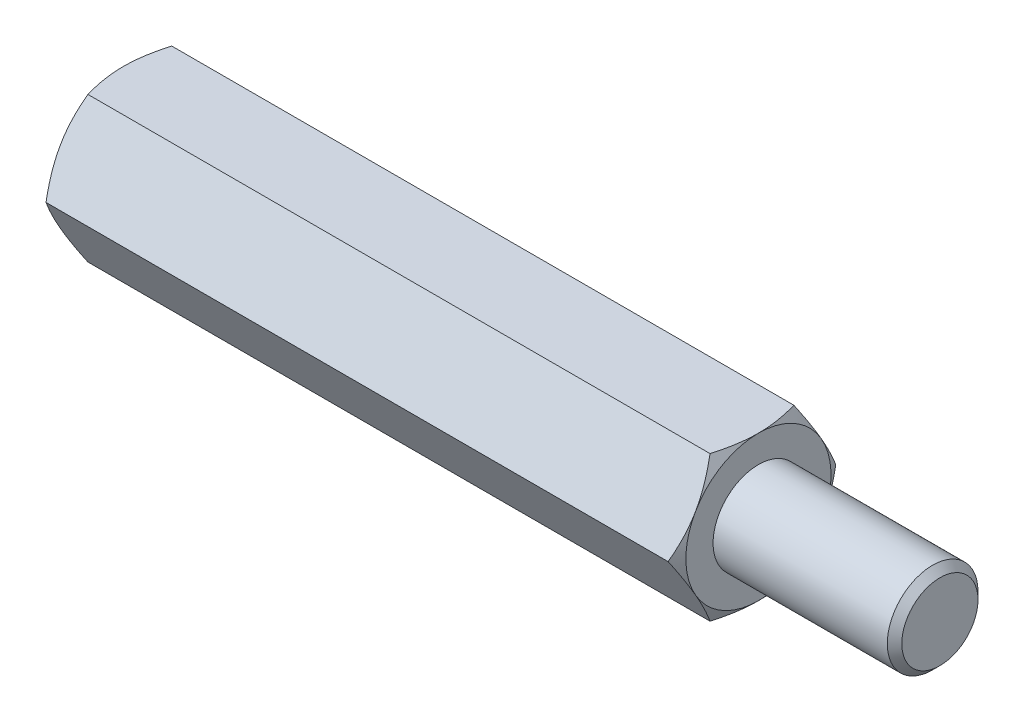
SolidWorks part; units mm, degrees
ref_plane "Front Plane" through (0, 0, 0) normal (0, 0, 1) x (1, 0, 0)
ref_plane "Top Plane" through (0, 0, 0) normal (0, 1, 0) x (1, 0, 0)
ref_plane "Right Plane" through (0, 0, 0) normal (1, 0, 0) x (0, 0, -1)
sketch "Sketch1" plane through (0, 0, 0) normal (1, 0, 0) x (0, 0, -1)
  line L1 (2.3094, 4) -> (-2.3094, 4)
  line L2 (-2.3094, 4) -> (-4.6188, 0)
  line L3 (-4.6188, 0) -> (-2.3094, -4)
  line L4 (-2.3094, -4) -> (2.3094, -4)
  line L5 (2.3094, -4) -> (4.6188, 0)
  line L6 (4.6188, 0) -> (2.3094, 4)
  circle A0 centre (0, 0) radius 4 construction
  dimension "D1" = 8
extrude "Extrude2" add sketch "Sketch1" along normal mid plane 35
sketch "Sketch2" plane through (0, 0, 0) normal (0, 0, 1) x (1, 0, 0)
  line L0 (-17.5, 4) -> (-16, 6.5981)
  line L1 (-17.5, 7) -> (-17.5, 4)
  line L3 (0, 0) -> (50000, 0) construction
  arc A0 (-16, 6.5981) -> (-17.5, 7) centre (-16.6962, 7) ccw
  dimension "D1" = 30
  dimension "D2" = 3
revolve "Cut-Revolve1" cut sketch "Sketch2" angle 360 about L3
mirror "Mirror1" about plane through (0, 0, 0) normal (1, 0, 0) of "Cut-Revolve1"
sketch "Sketch3" plane through (-17.5, 0, 0) normal (-1, 0, 0) x (0, 0, 1)
  circle A0 centre (0, 0) radius 2.1
  dimension "D1" = 4.2
extrude "Extrude3" cut sketch "Sketch3" against normal blind 10
sketch "Sketch4" plane through (0, 0, 0) normal (0, 0, 1) x (1, 0, 0)
  line L0 (-7.5, 0) -> (-7.5, 2.1)
  line L1 (17.1427, 0) -> (-17.1427, 0) construction
  line L2 (-7.5, 2.1) -> (-6.2876, 0)
  line L3 (-6.2876, 0) -> (-7.5, 0)
  line L4 (-17.5, 2) -> (-17.5, -2) construction
  point P4 (-17.5, 0)
  dimension "D1" = 30
  dimension "D2" = 2.1
  dimension "D3" = 10
revolve "Cut-Revolve2" cut sketch "Sketch4" angle 360 about L3
sketch "Sketch5" plane through (17.5, 0, 0) normal (1, 0, 0) x (0, 0, -1)
  circle A0 centre (0, 0) radius 2.5
  dimension "D1" = 5
extrude "Extrude4" add sketch "Sketch5" along normal blind 10
chamfer "Chamfer1" distance 0.4 angle 45 1 edges at (27.5, 0, -2.5)
equation "\"D2@Sketch4\" = \"D1@Sketch3\"/2"
